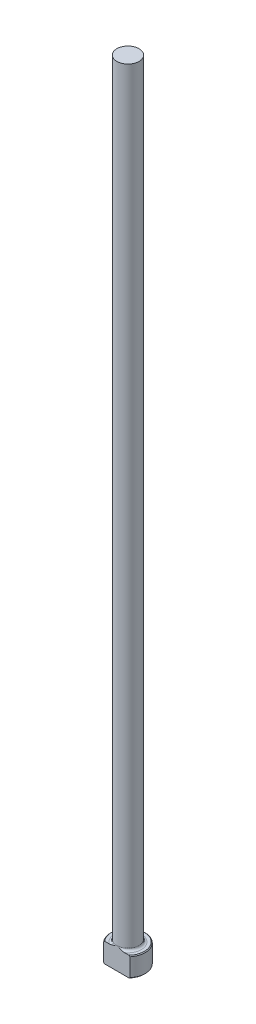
SolidWorks part; units mm, degrees
ref_plane "Front Plane" through (0, 0, 0) normal (0, 0, 1) x (1, 0, 0)
ref_plane "Top Plane" through (0, 0, 0) normal (0, 1, 0) x (1, 0, 0)
ref_plane "Right Plane" through (0, 0, 0) normal (1, 0, 0) x (0, 0, -1)
sketch "Sketch1" plane through (0, 0, 0) normal (0, 0, 1) x (1, 0, 0)
  line L0 (0, 259.9588) -> (0, -15.1925) construction
  line L1 (0, 0) -> (-5.5499, 0)
  line L2 (-5.5499, 0) -> (-5.5499, 6.35)
  line L3 (-5.5499, 6.35) -> (-3.5712, 6.35)
  line L4 (-3.5712, 6.35) -> (-3.5712, 254)
  line L5 (-3.5712, 254) -> (0, 254)
  line L6 (0, 254) -> (0, 0)
  dimension "L" = 254
  dimension "H" = 11.0998
  dimension "T" = 6.35
  dimension "D" = 7.1425
revolve "Revolve1" add sketch "Sketch1" angle 360 about L0
chamfer "Chamfer1" distance 0.254 angle 45 2 edges at (0, 6.35, 5.5499) (0, 0, 5.5499)
fillet "Fillet1" radius 0.762 1 edges at (0, 6.35, 3.5712)
sketch "Sketch2" plane through (0, 0, 0) normal (0, 1, 0) x (1, 0, 0)
  line L0 (-4.2483, -3.5712) -> (4.2483, -3.5712)
  circle A0 centre (0, 0) radius 5.5499 construction
  arc A1 (-4.2483, -3.5712) -> (4.2483, -3.5712) centre (0, 0) ccw
  circle A3 centre (0, 0) radius 3.5712 construction
  dimension "D1" = 0
extrude "Key" cut sketch "Sketch2" along normal through all
sketch "Pocket Sketch" plane through (0, 0, 0) normal (0, 0, 1) x (1, 0, 0)
  line L0 (-5.9468, 0) -> (-5.9468, 6.3754)
  line L1 (-5.9468, 6.3754) -> (-4.7301, 6.3754)
  line L2 (-3.9681, 7.1374) -> (-3.9681, 22.225)
  line L3 (-3.9681, 22.225) -> (0, 22.225)
  line L4 (0, 22.225) -> (0, 0)
  line L5 (0, 0) -> (-5.9468, 0)
  line L6 (0, 12.6104) -> (0, -2.4989) construction
  line L7 (-5.5499, 6.096) -> (-5.5499, 0.254) construction
  line L8 (5.2959, 6.35) -> (-5.2959, 6.35) construction
  line L9 (-3.5712, 254) -> (-3.5712, 7.112) construction
  line L10 (-4.7301, 6.3754) -> (-3.9681, 7.1374)
  point P3 (-3.9681, 6.3754)
  dimension "D1" = 11.8935
  dimension "D2" = 0.3969
  dimension "D3" = 0.0254
  dimension "D4" = 0.3969
  dimension "D5" = 7.9362
  dimension "D6" = 22.225
